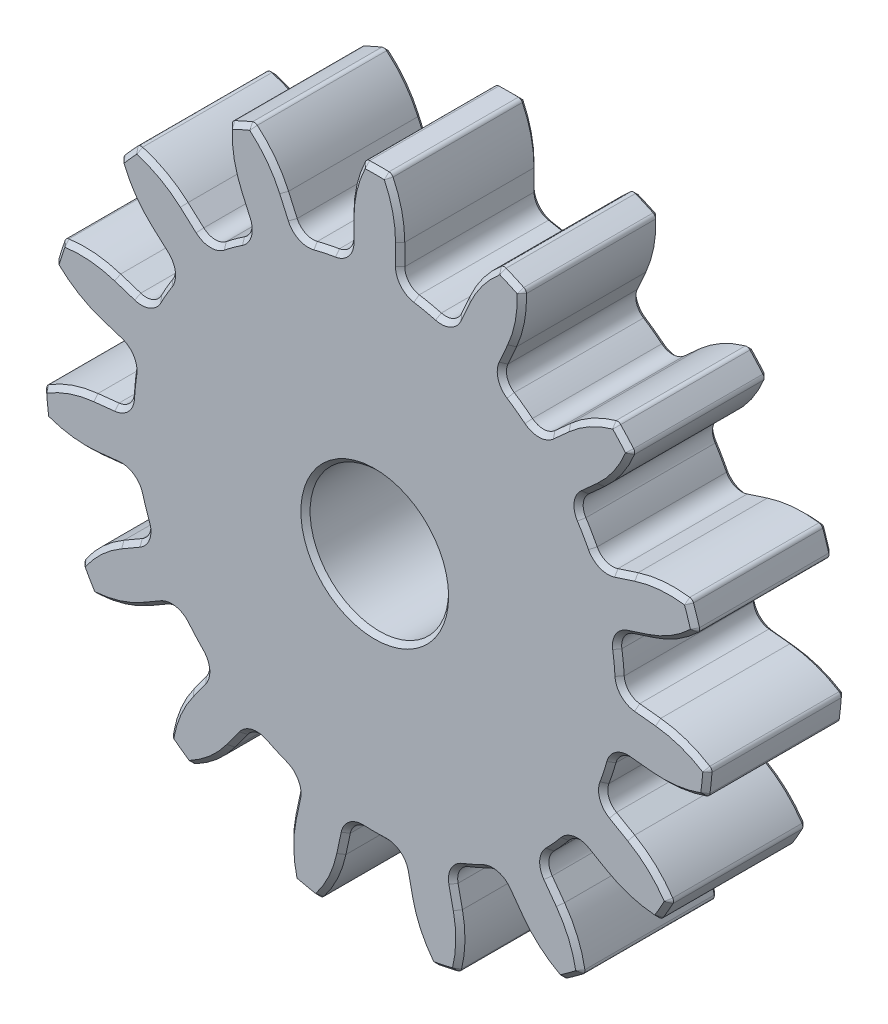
SolidWorks part; units mm, degrees
ref_plane "Спереди" through (0, 0, 0) normal (0, 0, 1) x (1, 0, 0)
ref_plane "Сверху" through (0, 0, 0) normal (0, 1, 0) x (1, 0, 0)
ref_plane "Справа" through (0, 0, 0) normal (1, 0, 0) x (0, 0, -1)
sketch "Эскиз1" plane through (0, 0, 0) normal (0, 0, 1) x (1, 0, 0)
  line L0 (0, 0) -> (0, 14.45) construction
  line L1 (-1.1, 12.1389) -> (-1.1, 11.2236)
  line L2 (1.1, 12.1389) -> (1.1, 11.2236)
  line L3 (3.9324, 11.5368) -> (3.5601, 10.7006)
  line L4 (5.9422, 10.642) -> (5.5699, 9.8058)
  line L5 (8.2849, 8.94) -> (7.6047, 8.3275)
  line L6 (9.757, 7.305) -> (9.0768, 6.6926)
  line L7 (11.2048, 4.7973) -> (10.3343, 4.5144)
  line L8 (11.8847, 2.705) -> (11.0142, 2.4221)
  line L9 (12.1874, -0.1749) -> (11.277, -0.0792)
  line L10 (11.9574, -2.3628) -> (11.0471, -2.2672)
  line L11 (11.0626, -5.1168) -> (10.2699, -4.6591)
  line L12 (9.9626, -7.0221) -> (9.1699, -6.5644)
  line L13 (8.025, -9.174) -> (7.487, -8.4335)
  line L14 (6.2451, -10.4671) -> (5.7071, -9.7266)
  line L15 (3.5998, -11.6449) -> (3.4095, -10.7496)
  line L16 (1.4479, -12.1023) -> (1.2575, -11.207)
  line L17 (-1.4479, -12.1023) -> (-1.2575, -11.207)
  line L18 (-3.5998, -11.6449) -> (-3.4095, -10.7496)
  line L19 (-6.2451, -10.4671) -> (-5.7071, -9.7266)
  line L20 (-8.025, -9.174) -> (-7.487, -8.4335)
  line L21 (-9.9626, -7.0221) -> (-9.1699, -6.5644)
  line L22 (-11.0626, -5.1168) -> (-10.2699, -4.6591)
  line L23 (-11.9574, -2.3628) -> (-11.0471, -2.2672)
  line L24 (-12.1874, -0.1749) -> (-11.277, -0.0792)
  line L25 (-11.8847, 2.705) -> (-11.0142, 2.4221)
  line L26 (-11.2048, 4.7973) -> (-10.3343, 4.5144)
  line L27 (-9.757, 7.305) -> (-9.0768, 6.6926)
  line L28 (-8.2849, 8.94) -> (-7.6047, 8.3275)
  line L29 (-5.9422, 10.642) -> (-5.5699, 9.8058)
  line L30 (-3.9324, 11.5368) -> (-3.5601, 10.7006)
  line L33 (-1.1, 12.1389) -> (-1.1, 11.2236)
  line L34 (1.1, 12.1389) -> (1.1, 11.2236)
  circle A0 centre (0, 0) radius 3
  arc A1 (0.4196, 14.4439) -> (-0.4196, 14.4439) centre (0, 0) ccw
  circle A2 centre (0, 0) radius 12.75 construction
  arc A3 (-5.8427, 8.8743) -> (-6.6345, 8.299) centre (0, 0) ccw
  arc A4 (-0.5935, 14.3317) -> (-1.1, 12.1389) centre (3.9, 12.1389) ccw
  arc A5 (0.5935, 14.3317) -> (1.1, 12.1389) centre (-3.9, 12.1389) cw
  arc A6 (0.5935, 14.3317) -> (0.4196, 14.4439) centre (0.4138, 14.244) ccw
  arc A7 (-0.5935, 14.3317) -> (-0.4196, 14.4439) centre (-0.4138, 14.244) cw
  arc A8 (5.287, 13.3341) -> (3.9324, 11.5368) centre (8.5002, 9.5031) ccw
  arc A9 (5.287, 13.3341) -> (5.4916, 13.3658) centre (5.4156, 13.1808) cw
  arc A10 (6.2582, 13.0245) -> (5.4916, 13.3658) centre (0, 0) ccw
  arc A11 (6.3714, 12.8513) -> (6.2582, 13.0245) centre (6.1715, 12.8442) ccw
  arc A12 (6.3714, 12.8513) -> (5.9422, 10.642) centre (1.3745, 12.6757) cw
  arc A13 (10.2534, 10.0308) -> (8.2849, 8.94) centre (11.6306, 5.2242) ccw
  arc A14 (10.2534, 10.0308) -> (10.4532, 9.9767) centre (10.3085, 9.8386) cw
  arc A15 (11.0147, 9.3531) -> (10.4532, 9.9767) centre (0, 0) ccw
  arc A16 (11.0477, 9.1487) -> (11.0147, 9.3531) centre (10.8622, 9.2236) ccw
  arc A17 (11.0477, 9.1487) -> (9.757, 7.305) centre (6.4113, 11.0208) cw
  arc A18 (13.4469, 4.9932) -> (11.2048, 4.7973) centre (12.7499, 0.042) ccw
  arc A19 (13.4469, 4.9932) -> (13.6073, 4.8624) centre (13.419, 4.7951) cw
  arc A20 (13.8666, 4.0644) -> (13.6073, 4.8624) centre (0, 0) ccw
  arc A21 (13.8137, 3.8643) -> (13.8666, 4.0644) centre (13.6747, 4.0081) ccw
  arc A22 (13.8137, 3.8643) -> (11.8847, 2.705) centre (10.3396, 7.4602) cw
  arc A23 (14.3152, -0.9078) -> (12.1874, -0.1749) centre (11.6647, -5.1475) ccw
  arc A24 (14.3152, -0.9078) -> (14.4086, -1.0925) centre (14.2092, -1.0774) cw
  arc A25 (14.3209, -1.9271) -> (14.4086, -1.0925) centre (0, 0) ccw
  arc A26 (14.1912, -2.0883) -> (14.3209, -1.9271) centre (14.1227, -1.9004) ccw
  arc A27 (14.1912, -2.0883) -> (11.9574, -2.3628) centre (12.48, 2.6098) cw
  arc A28 (12.7084, -6.6519) -> (11.0626, -5.1168) centre (8.5626, -9.4469) ccw
  arc A29 (12.7084, -6.6519) -> (12.7186, -6.8586) centre (12.5425, -6.7637) cw
  arc A30 (12.299, -7.5853) -> (12.7186, -6.8586) centre (0, 0) ccw
  arc A31 (12.1149, -7.6798) -> (12.299, -7.5853) centre (12.1288, -7.4803) ccw
  arc A32 (12.1149, -7.6798) -> (9.9626, -7.0221) centre (12.4626, -2.6919) cw
  arc A33 (8.9041, -11.2457) -> (8.025, -9.174) centre (3.9799, -12.1129) ccw
  arc A34 (8.9041, -11.2457) -> (8.8294, -11.4388) centre (8.7071, -11.2804) cw
  arc A35 (8.1505, -11.932) -> (8.8294, -11.4388) centre (0, 0) ccw
  arc A36 (7.9438, -11.9434) -> (8.1505, -11.932) centre (8.0377, -11.7668) ccw
  arc A37 (7.9438, -11.9434) -> (6.2451, -10.4671) centre (10.2902, -7.5282) cw
  arc A38 (3.5603, -13.8951) -> (3.5998, -11.6449) centre (-1.291, -12.6845) ccw
  arc A39 (3.5603, -13.8951) -> (3.4135, -14.041) centre (3.3662, -13.8467) cw
  arc A40 (2.5927, -14.2155) -> (3.4135, -14.041) centre (0, 0) ccw
  arc A41 (2.3992, -14.1419) -> (2.5927, -14.2155) centre (2.5568, -14.0188) ccw
  arc A42 (2.3992, -14.1419) -> (1.4479, -12.1023) centre (6.3386, -11.0628) cw
  arc A43 (-2.3992, -14.1419) -> (-1.4479, -12.1023) centre (-6.3386, -11.0628) ccw
  arc A44 (-2.3992, -14.1419) -> (-2.5927, -14.2155) centre (-2.5568, -14.0188) cw
  arc A45 (-3.4135, -14.041) -> (-2.5927, -14.2155) centre (0, 0) ccw
  arc A46 (-3.5603, -13.8951) -> (-3.4135, -14.041) centre (-3.3662, -13.8467) ccw
  arc A47 (-3.5603, -13.8951) -> (-3.5998, -11.6449) centre (1.291, -12.6845) cw
  arc A48 (-7.9438, -11.9434) -> (-6.2451, -10.4671) centre (-10.2902, -7.5282) ccw
  arc A49 (-7.9438, -11.9434) -> (-8.1505, -11.932) centre (-8.0377, -11.7668) cw
  arc A50 (-8.8294, -11.4388) -> (-8.1505, -11.932) centre (0, 0) ccw
  arc A51 (-8.9041, -11.2457) -> (-8.8294, -11.4388) centre (-8.7071, -11.2804) ccw
  arc A52 (-8.9041, -11.2457) -> (-8.025, -9.174) centre (-3.9799, -12.1129) cw
  arc A53 (-12.1149, -7.6798) -> (-9.9626, -7.0221) centre (-12.4626, -2.6919) ccw
  arc A54 (-12.1149, -7.6798) -> (-12.299, -7.5853) centre (-12.1288, -7.4803) cw
  arc A55 (-12.7186, -6.8586) -> (-12.299, -7.5853) centre (0, 0) ccw
  arc A56 (-12.7084, -6.6519) -> (-12.7186, -6.8586) centre (-12.5425, -6.7637) ccw
  arc A57 (-12.7084, -6.6519) -> (-11.0626, -5.1168) centre (-8.5626, -9.4469) cw
  arc A58 (-14.1912, -2.0883) -> (-11.9574, -2.3628) centre (-12.48, 2.6098) ccw
  arc A59 (-14.1912, -2.0883) -> (-14.3209, -1.9271) centre (-14.1227, -1.9004) cw
  arc A60 (-14.4086, -1.0925) -> (-14.3209, -1.9271) centre (0, 0) ccw
  arc A61 (-14.3152, -0.9078) -> (-14.4086, -1.0925) centre (-14.2092, -1.0774) ccw
  arc A62 (-14.3152, -0.9078) -> (-12.1874, -0.1749) centre (-11.6647, -5.1475) cw
  arc A63 (-13.8137, 3.8643) -> (-11.8847, 2.705) centre (-10.3396, 7.4602) ccw
  arc A64 (-13.8137, 3.8643) -> (-13.8666, 4.0644) centre (-13.6747, 4.0081) cw
  arc A65 (-13.6073, 4.8624) -> (-13.8666, 4.0644) centre (0, 0) ccw
  arc A66 (-13.4469, 4.9932) -> (-13.6073, 4.8624) centre (-13.419, 4.7951) ccw
  arc A67 (-13.4469, 4.9932) -> (-11.2048, 4.7973) centre (-12.7499, 0.042) cw
  arc A68 (-11.0477, 9.1487) -> (-9.757, 7.305) centre (-6.4113, 11.0208) ccw
  arc A69 (-11.0477, 9.1487) -> (-11.0147, 9.3531) centre (-10.8622, 9.2236) cw
  arc A70 (-10.4532, 9.9767) -> (-11.0147, 9.3531) centre (0, 0) ccw
  arc A71 (-10.2534, 10.0308) -> (-10.4532, 9.9767) centre (-10.3085, 9.8386) ccw
  arc A72 (-10.2534, 10.0308) -> (-8.2849, 8.94) centre (-11.6306, 5.2242) cw
  arc A73 (-6.3714, 12.8513) -> (-5.9422, 10.642) centre (-1.3745, 12.6757) ccw
  arc A74 (-6.3714, 12.8513) -> (-6.2582, 13.0245) centre (-6.1715, 12.8442) cw
  arc A75 (-5.4916, 13.3658) -> (-6.2582, 13.0245) centre (0, 0) ccw
  arc A76 (-5.287, 13.3341) -> (-5.4916, 13.3658) centre (-5.4156, 13.1808) ccw
  arc A77 (-5.287, 13.3341) -> (-3.9324, 11.5368) centre (-8.5002, 9.5031) cw
  arc A83 (-8.9471, 5.7307) -> (-9.4364, 4.883) centre (0, 0) ccw
  arc A84 (-10.5044, 1.5961) -> (-10.6067, 0.6227) centre (0, 0) ccw
  arc A85 (-1.728, 10.4835) -> (-2.6854, 10.28) centre (0, 0) ccw
  arc A86 (2.6854, 10.28) -> (1.728, 10.4835) centre (0, 0) ccw
  arc A87 (6.6345, 8.299) -> (5.8427, 8.8743) centre (0, 0) ccw
  arc A88 (9.4364, 4.883) -> (8.9471, 5.7307) centre (0, 0) ccw
  arc A89 (10.6067, 0.6227) -> (10.5044, 1.5961) centre (0, 0) ccw
  arc A90 (9.943, -3.7453) -> (10.2455, -2.8144) centre (0, 0) ccw
  arc A91 (7.5601, -7.4657) -> (8.215, -6.7383) centre (0, 0) ccw
  arc A92 (3.8699, -9.8952) -> (4.7641, -9.4971) centre (0, 0) ccw
  arc A93 (-0.4894, -10.6137) -> (0.4894, -10.6137) centre (0, 0) ccw
  arc A95 (-4.7641, -9.4971) -> (-3.8699, -9.8952) centre (0, 0) ccw
  arc A96 (-8.215, -6.7383) -> (-7.5601, -7.4657) centre (0, 0) ccw
  arc A97 (-10.2455, -2.8144) -> (-9.943, -3.7453) centre (0, 0) ccw
  arc A98 (5.7071, -9.7266) -> (4.7641, -9.4971) centre (5.1004, -10.1674) ccw
  arc A99 (3.4095, -10.7496) -> (3.8699, -9.8952) centre (4.1431, -10.5937) cw
  arc A100 (1.2575, -11.207) -> (0.4894, -10.6137) centre (0.5239, -11.3629) ccw
  arc A101 (-1.2575, -11.207) -> (-0.4894, -10.6137) centre (-0.5239, -11.3629) cw
  arc A104 (-3.4095, -10.7496) -> (-3.8699, -9.8952) centre (-4.1431, -10.5937) ccw
  arc A105 (-5.7071, -9.7266) -> (-4.7641, -9.4971) centre (-5.1004, -10.1674) cw
  arc A106 (-7.487, -8.4335) -> (-7.5601, -7.4657) centre (-8.0937, -7.9926) ccw
  arc A107 (-9.1699, -6.5644) -> (-8.215, -6.7383) centre (-8.7949, -7.2139) cw
  arc A108 (-10.2699, -4.6591) -> (-9.943, -3.7453) centre (-10.6449, -4.0096) ccw
  arc A109 (-11.0471, -2.2672) -> (-10.2455, -2.8144) centre (-10.9687, -3.013) cw
  arc A110 (-11.277, -0.0792) -> (-10.6067, 0.6227) centre (-11.3554, 0.6667) ccw
  arc A111 (-11.0142, 2.4221) -> (-10.5044, 1.5961) centre (-11.2459, 1.7088) cw
  arc A112 (-10.3343, 4.5144) -> (-9.4364, 4.883) centre (-10.1026, 5.2277) ccw
  arc A113 (-9.0768, 6.6926) -> (-8.9471, 5.7307) centre (-9.5786, 6.1352) cw
  arc A114 (7.487, -8.4335) -> (7.5601, -7.4657) centre (8.0937, -7.9926) cw
  arc A115 (9.1699, -6.5644) -> (8.215, -6.7383) centre (8.7949, -7.2139) ccw
  arc A116 (10.2699, -4.6591) -> (9.943, -3.7453) centre (10.6449, -4.0096) cw
  arc A117 (11.0471, -2.2672) -> (10.2455, -2.8144) centre (10.9687, -3.013) ccw
  arc A118 (11.277, -0.0792) -> (10.6067, 0.6227) centre (11.3554, 0.6667) cw
  arc A119 (11.0142, 2.4221) -> (10.5044, 1.5961) centre (11.2459, 1.7088) ccw
  arc A120 (10.3343, 4.5144) -> (9.4364, 4.883) centre (10.1026, 5.2277) cw
  arc A121 (9.0768, 6.6926) -> (8.9471, 5.7307) centre (9.5786, 6.1352) ccw
  arc A122 (7.6047, 8.3275) -> (6.6345, 8.299) centre (7.1028, 8.8848) cw
  arc A123 (5.5699, 9.8058) -> (5.8427, 8.8743) centre (6.2551, 9.5008) ccw
  arc A124 (3.5601, 10.7006) -> (2.6854, 10.28) centre (2.875, 11.0057) cw
  arc A125 (1.1, 11.2236) -> (1.728, 10.4835) centre (1.85, 11.2236) ccw
  arc A126 (-1.1, 11.2236) -> (-1.728, 10.4835) centre (-1.85, 11.2236) cw
  arc A127 (-3.5601, 10.7006) -> (-2.6854, 10.28) centre (-2.875, 11.0057) ccw
  arc A128 (-5.5699, 9.8058) -> (-5.8427, 8.8743) centre (-6.2551, 9.5008) cw
  arc A129 (-7.6047, 8.3275) -> (-6.6345, 8.299) centre (-7.1028, 8.8848) ccw
  arc A130 (-0.5935, 14.3317) -> (-1.1, 12.1389) centre (3.9, 12.1389) ccw
  arc A131 (-0.5935, 14.3317) -> (-0.4196, 14.4439) centre (-0.4138, 14.244) cw
  arc A132 (0.4196, 14.4439) -> (-0.4196, 14.4439) centre (0, 0) ccw
  arc A133 (0.5935, 14.3317) -> (0.4196, 14.4439) centre (0.4138, 14.244) ccw
  arc A134 (0.5935, 14.3317) -> (1.1, 12.1389) centre (-3.9, 12.1389) cw
  point P16 (0.539, 14.4399)
  point P19 (-0.539, 14.4399)
  point P270 (1.1, 10.5679)
  point P273 (-1.1, 10.5679)
  dimension "D1" = 6
  dimension "D2" = 28.9
  dimension "D3" = 25.5
  dimension "D4" = 21.25
  dimension "D6" = 10
  dimension "D7" = 0.2
  dimension "D9" = 0.75
  dimension "D10" = 0.75
  dimension "D5" = 2.2
  dimension "D8" = 15
extrude "Бобышка-Вытянуть1" add sketch "Эскиз1" along normal blind 6
chamfer "Фаска1" distance 0.2 angle 45 302 edges at (-0.5222, 14.4121, 6) (-13.868, 3.957, 6) (-12.9152, 3.1747, 6) (-11.4494, 2.5635, 6) (-10.6077, 2.1027, 6) (-10.5668, 1.1106, 6) (-10.813, 0.1487, 6) (-11.7322, -0.127, 6) (-13.2931, -0.4201, 6) (0.9717, 13.2642, 0) (1.1, 11.6812, 0) (1.2782, 10.7383, 0) (2.2091, 10.3928, 0) (3.2, 10.3298, 0) (3.7463, 11.1187, 0) (4.5073, 12.5127, 0) (-14.3877, -0.9872, 6) (5.3849, 13.3785, 0) (5.8773, 13.2007, 0) (6.3389, 12.9537, 0) (6.2827, 11.7222, 0) (5.7561, 10.2239, 0) (5.5353, 9.29, 0) (6.2452, 8.5958, 0) (7.1248, 8.1352, 0) (-14.3708, -1.5104, 6) (7.9448, 8.6337, 0) (9.207, 9.5976, 0) (10.3608, 10.0316, 0) (10.7384, 9.6689, 0) (11.0596, 9.2555, 0) (10.5074, 8.1533, 0) (9.4169, 6.9988, 0) (-0.9717, 13.2642, 6) (-14.2785, -2.0258, 6) (8.8353, 6.2354, 0) (9.2015, 5.3125, 0) (9.8177, 4.5339, 0) (10.7696, 4.6559, 0) (12.3147, 5.023, 0) (13.5453, 4.9502, 0) (13.7428, 4.4653, 0) (13.868, 3.957, 0) (-13.0899, -2.3529, 6) (12.9152, 3.1747, 0) (11.4494, 2.5635, 0) (10.6077, 2.1027, 0) (10.5668, 1.1106, 0) (10.813, 0.1487, 0) (11.7322, -0.127, 0) (13.2931, -0.4201, 0) (-11.5022, -2.315, 6) (14.3877, -0.9872, 0) (14.3708, -1.5104, 0) (14.2785, -2.0258, 0) (13.0899, -2.3529, 0) (11.5022, -2.315, 0) (10.5458, -2.3936, 0) (10.105, -3.2833, 0) (9.9387, -4.2622, 0) (-10.5458, -2.3936, 6) (10.6662, -4.888, 0) (11.973, -5.7905, 0) (12.7423, -6.7538, 0) (12.5141, -7.225, 0) (12.2201, -7.6582, 0) (11.0012, -7.4736, 0) (9.5662, -6.7932, 0) (-10.105, -3.2833, 6) (8.6605, -6.4761, 0) (7.8959, -7.1095, 0) (7.3459, -7.9361, 0) (7.756, -8.8037, 0) (8.5826, -10.1598, 0) (8.8936, -11.3527, 0) (8.4935, -11.6903, 0) (8.0487, -11.9665, 0) (-9.9387, -4.2622, 6) (7.0103, -11.3021, 0) (5.9761, -10.0969, 0) (5.2777, -9.4387, 0) (4.3216, -9.7064, 0) (3.4828, -10.2379, 0) (3.5046, -11.1973, 0) (3.7083, -12.7723, 0) (-10.6662, -4.888, 6) (3.5072, -13.9886, 0) (3.0043, -14.1342, 0) (2.4857, -14.2057, 0) (1.8073, -13.1763, 0) (1.3527, -11.6547, 0) (0.9824, -10.7693, 0) (0, -10.625, 0) (-0.9824, -10.7693, 0) (-11.973, -5.7905, 6) (-1.3527, -11.6547, 0) (-1.8073, -13.1763, 0) (-2.4857, -14.2057, 0) (-3.0043, -14.1342, 0) (-3.5072, -13.9886, 0) (-3.7083, -12.7723, 0) (-3.5046, -11.1973, 0) (-12.7423, -6.7538, 6) (-3.4828, -10.2379, 0) (-4.3216, -9.7064, 0) (-5.2777, -9.4387, 0) (-5.9761, -10.0969, 0) (-7.0103, -11.3021, 0) (-8.0487, -11.9665, 0) (-8.4935, -11.6903, 0) (-8.8936, -11.3527, 0) (-12.5141, -7.225, 6) (-8.5826, -10.1598, 0) (-7.756, -8.8037, 0) (-7.3459, -7.9361, 0) (-7.8959, -7.1095, 0) (-8.6605, -6.4761, 0) (-9.5662, -6.7932, 0) (-11.0012, -7.4736, 0) (-1.1, 11.6812, 6) (-12.2201, -7.6582, 6) (-12.2201, -7.6582, 0) (-12.5141, -7.225, 0) (-12.7423, -6.7538, 0) (-11.973, -5.7905, 0) (-10.6662, -4.888, 0) (-9.9387, -4.2622, 0) (-10.105, -3.2833, 0) (-10.5458, -2.3936, 0) (-11.0012, -7.4736, 6) (-11.5022, -2.315, 0) (-13.0899, -2.3529, 0) (-14.2785, -2.0258, 0) (-14.3708, -1.5104, 0) (-14.3877, -0.9872, 0) (-13.2931, -0.4201, 0) (-11.7322, -0.127, 0) (-9.5662, -6.7932, 6) (-10.813, 0.1487, 0) (-10.5668, 1.1106, 0) (-10.6077, 2.1027, 0) (-11.4494, 2.5635, 0) (-12.9152, 3.1747, 0) (-13.868, 3.957, 0) (-13.7428, 4.4653, 0) (-13.5453, 4.9502, 0) (-8.6605, -6.4761, 6) (-12.3147, 5.023, 0) (-10.7696, 4.6559, 0) (-9.8177, 4.5339, 0) (-9.2015, 5.3125, 0) (-8.8353, 6.2354, 0) (-9.4169, 6.9988, 0) (-10.5074, 8.1533, 0) (-7.8959, -7.1095, 6) (-11.0596, 9.2555, 0) (-10.7384, 9.6689, 0) (-10.3608, 10.0316, 0) (-9.207, 9.5976, 0) (-7.9448, 8.6337, 0) (-7.1248, 8.1352, 0) (-6.2452, 8.5958, 0) (-5.5353, 9.29, 0) (-7.3459, -7.9361, 6) (-5.7561, 10.2239, 0) (-6.2827, 11.7222, 0) (-6.3389, 12.9537, 0) (-5.8773, 13.2007, 0) (-5.3849, 13.3785, 0) (-4.5073, 12.5127, 0) (-3.7463, 11.1187, 0) (-7.756, -8.8037, 6) (-3.2, 10.3298, 0) (-2.2091, 10.3928, 0) (-1.2782, 10.7383, 0) (-1.1, 11.6812, 0) (-0.9717, 13.2642, 0) (-0.5222, 14.4121, 0) (0, 14.45, 0) (0.5222, 14.4121, 0) (-8.5826, -10.1598, 6) (-8.8936, -11.3527, 6) (-8.4935, -11.6903, 6) (-1.2782, 10.7383, 6) (-8.0487, -11.9665, 6) (-7.0103, -11.3021, 6) (-5.9761, -10.0969, 6) (-5.2777, -9.4387, 6) (-4.3216, -9.7064, 6) (-3.4828, -10.2379, 6) (-3.5046, -11.1973, 6) (-3.7083, -12.7723, 6) (-3.5072, -13.9886, 6) (-3.0043, -14.1342, 6) (-2.2091, 10.3928, 6) (-2.4857, -14.2057, 6) (-1.8073, -13.1763, 6) (-1.3527, -11.6547, 6) (-0.9824, -10.7693, 6) (0, -10.625, 6) (0.9824, -10.7693, 6) (1.3527, -11.6547, 6) (1.8073, -13.1763, 6) (2.4857, -14.2057, 6) (3.0043, -14.1342, 6) (-3.2, 10.3298, 6) (3.5072, -13.9886, 6) (3.7083, -12.7723, 6) (3.5046, -11.1973, 6) (3.4828, -10.2379, 6) (4.3216, -9.7064, 6) (5.2777, -9.4387, 6) (5.9761, -10.0969, 6) (7.0103, -11.3021, 6) (8.0487, -11.9665, 6) (8.4935, -11.6903, 6) (-3.7463, 11.1187, 6) (8.8936, -11.3527, 6) (8.5826, -10.1598, 6) (7.756, -8.8037, 6) (7.3459, -7.9361, 6) (7.8959, -7.1095, 6) (8.6605, -6.4761, 6) (9.5662, -6.7932, 6) (11.0012, -7.4736, 6) (12.2201, -7.6582, 6) (12.5141, -7.225, 6) (-4.5073, 12.5127, 6) (12.7423, -6.7538, 6) (11.973, -5.7905, 6) (10.6662, -4.888, 6) (9.9387, -4.2622, 6) (10.105, -3.2833, 6) (10.5458, -2.3936, 6) (11.5022, -2.315, 6) (13.0899, -2.3529, 6) (3, 0, 0) (3, 0, 6) (14.2785, -2.0258, 6) (14.3708, -1.5104, 6) (-5.3849, 13.3785, 6) (14.3877, -0.9872, 6) (13.2931, -0.4201, 6) (11.7322, -0.127, 6) (10.813, 0.1487, 6) (10.5668, 1.1106, 6) (10.6077, 2.1027, 6) (11.4494, 2.5635, 6) (12.9152, 3.1747, 6) (13.868, 3.957, 6) (13.7428, 4.4653, 6) (-5.8773, 13.2007, 6) (13.5453, 4.9502, 6) (12.3147, 5.023, 6) (10.7696, 4.6559, 6) (9.8177, 4.5339, 6) (9.2015, 5.3125, 6) (8.8353, 6.2354, 6) (9.4169, 6.9988, 6) (10.5074, 8.1533, 6) (11.0596, 9.2555, 6) (10.7384, 9.6689, 6) (0.5222, 14.4121, 6) (-6.3389, 12.9537, 6) (10.3608, 10.0316, 6) (9.207, 9.5976, 6) (7.9448, 8.6337, 6) (7.1248, 8.1352, 6) (6.2452, 8.5958, 6) (5.5353, 9.29, 6) (5.7561, 10.2239, 6) (6.2827, 11.7222, 6) (6.3389, 12.9537, 6) (5.8773, 13.2007, 6) (-6.2827, 11.7222, 6) (5.3849, 13.3785, 6) (4.5073, 12.5127, 6) (3.7463, 11.1187, 6) (3.2, 10.3298, 6) (2.2091, 10.3928, 6) (1.2782, 10.7383, 6) (1.1, 11.6812, 6) (0.9717, 13.2642, 6) (-5.7561, 10.2239, 6) (-5.5353, 9.29, 6) (-6.2452, 8.5958, 6) (-7.1248, 8.1352, 6) (-7.9448, 8.6337, 6) (-9.207, 9.5976, 6) (-10.3608, 10.0316, 6) (-10.7384, 9.6689, 6) (0, 14.45, 6) (-11.0596, 9.2555, 6) (-10.5074, 8.1533, 6) (-9.4169, 6.9988, 6) (-8.8353, 6.2354, 6) (-9.2015, 5.3125, 6) (-9.8177, 4.5339, 6) (-10.7696, 4.6559, 6) (-12.3147, 5.023, 6) (-13.5453, 4.9502, 6) (-13.7428, 4.4653, 6)
